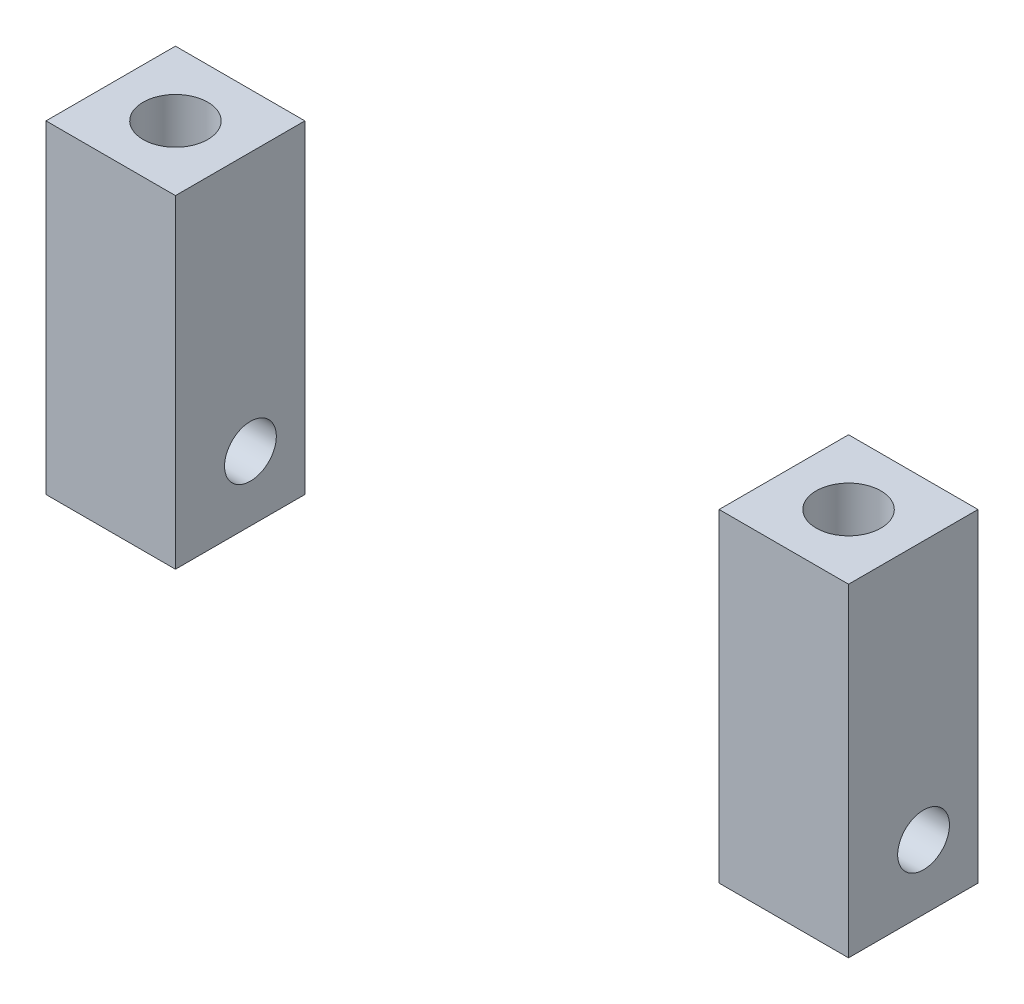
SolidWorks part; units mm, degrees
ref_plane "Ebene vorne" through (0, 0, 0) normal (0, 0, 1) x (1, 0, 0)
ref_plane "Ebene oben" through (0, 0, 0) normal (0, 1, 0) x (1, 0, 0)
ref_plane "Ebene rechts" through (0, 0, 0) normal (1, 0, 0) x (0, 0, -1)
sketch "Skizze1" plane through (0, 0, 0) normal (0, 1, 0) x (1, 0, 0)
  line L1 (13.805, 4.2054) -> (3.805, 4.2054)
  line L2 (13.805, 4.2054) -> (13.805, -5.7946)
  line L3 (13.805, -5.7946) -> (3.805, -5.7946)
  line L4 (3.805, 4.2054) -> (3.805, -5.7946)
  line L6 (-48.195, 4.2054) -> (-38.195, 4.2054)
  line L7 (-48.195, 4.2054) -> (-48.195, -5.7946)
  line L8 (-48.195, -5.7946) -> (-38.195, -5.7946)
  line L9 (-38.195, 4.2054) -> (-38.195, -5.7946)
  line L10 (-48.195, 4.2054) -> (-38.195, -5.7946) construction
  line L11 (-48.195, -5.7946) -> (-38.195, 4.2054) construction
  dimension "D1" = 10
  dimension "D2" = 10
  dimension "D4" = 10
  dimension "D5" = 10
extrude "Aufsatz-Linear austragen1" add sketch "Skizze1" along normal blind 25
sketch "Skizze2" plane through (0, 25, 0) normal (0, 1, 0) x (1, 0, 0)
  circle A0 centre (8.805, -0.7946) radius 2.5
  circle A1 centre (-43.195, -0.7946) radius 2.5
extrude "Schnitt-Linear austragen1" cut sketch "Skizze2" against normal blind 15
sketch "Skizze3" plane through (13.805, 0, 0) normal (1, 0, 0) x (0, 0, -1)
  circle A0 centre (0, 5) radius 2
extrude "Schnitt-Linear austragen3" cut sketch "Skizze3" against normal blind 62
